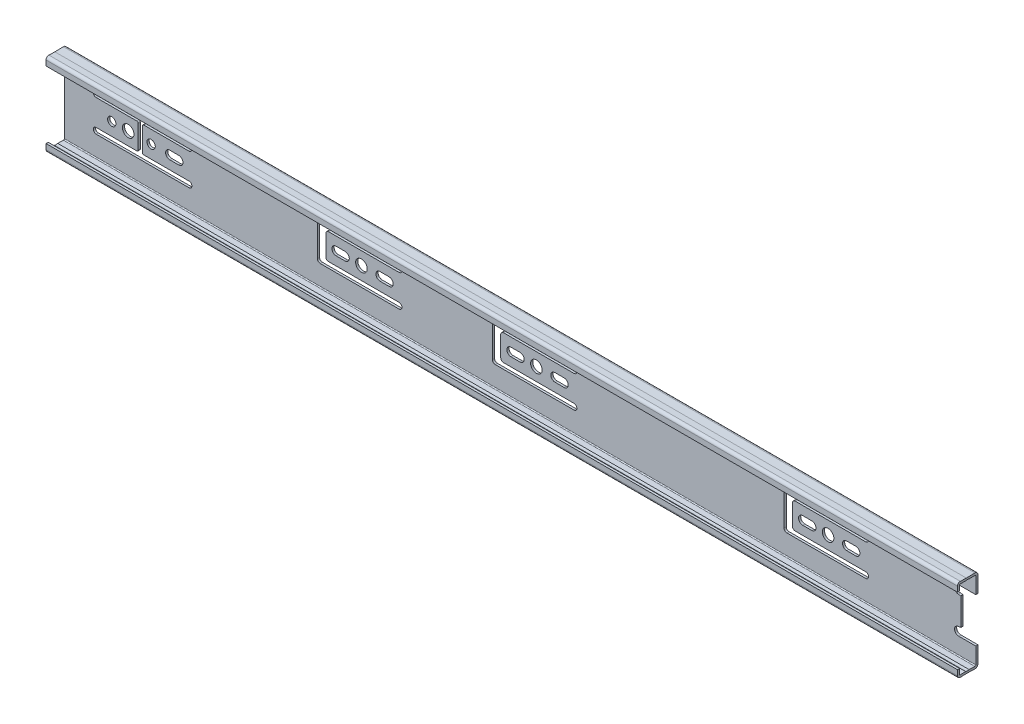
SolidWorks part; units mm, degrees
ref_plane "Front Plane" through (0, 0, 0) normal (0, 0, 1) x (1, 0, 0)
ref_plane "Top Plane" through (0, 0, 0) normal (0, 1, 0) x (1, 0, 0)
ref_plane "Right Plane" through (0, 0, 0) normal (1, 0, 0) x (0, 0, -1)
imported_body "Imported3"
sketch "Sketch1" plane through (240.6664, 0, 0) normal (1, 0, 0) x (0, 0, -1)
  line L0 (-4.445, 22.866) -> (5.6388, 22.866)
  line L1 (5.6388, 22.866) -> (5.6388, 12.2048)
  line L2 (5.6388, 12.2048) -> (4.445, 12.2048)
  line L3 (4.445, 12.2048) -> (4.445, 21.6406)
  line L4 (4.445, 21.6406) -> (0.7619, 21.5441)
  line L5 (-1.1312, 21.5182) -> (-4.445, 21.6367)
  line L6 (-4.445, 21.6367) -> (-4.445, 22.866)
  arc A0 (0.7619, 21.5441) -> (-1.1312, 21.5182) centre (-0.1524, 19.1744) ccw
  dimension "D1" = 2.54
  dimension "D2" = 3.3138
  dimension "D3" = 4.2926
  dimension "D4" = 5.2069
  dimension "D5" = 8.89
  dimension "D6" = 10.0838
  dimension "D7" = 0.0039
  dimension "D8" = 1.2294
  dimension "D9" = 1.2333
  dimension "D10" = 1.3259
  dimension "D13" = 10.6652
extrude "Boss-Extrude1" add sketch "Sketch1" along normal blind 9.3966
sketch "Sketch2" plane through (240.6664, 0, 0) normal (1, 0, 0) x (0, 0, -1)
  line L0 (-4.445, -21.6367) -> (-1.1312, -21.5182)
  line L1 (0.7619, -21.5441) -> (4.445, -21.6406)
  line L2 (4.445, -21.6406) -> (4.445, -12.2048)
  line L3 (4.445, -12.2048) -> (5.6388, -12.2048)
  line L4 (5.6388, -12.2048) -> (5.6388, -22.866)
  line L5 (5.6388, -22.866) -> (-4.445, -22.866)
  line L6 (-4.445, -22.866) -> (-4.445, -21.6367)
  line L7 (5.6388, -12.2048) -> (5.6388, -22.866) construction
  arc A0 (-1.1312, -21.5182) -> (0.7619, -21.5441) centre (-0.1524, -19.1744) ccw
  dimension "D1" = 2.54
  dimension "D2" = 1.1938
  dimension "D3" = 4.8769
  dimension "D4" = 5.7912
  dimension "D5" = 6.77
  dimension "D6" = 10.0838
  dimension "D7" = 6.9696
  dimension "D10" = 9.4319
  dimension "D11" = 9.4358
  dimension "D12" = 10.6613
extrude "Boss-Extrude2" add sketch "Sketch2" along normal blind 9.3966
sketch "Sketch3" plane through (0, 0, 4.445) normal (0, 0, 1) x (1, 0, 0)
  line L0 (250.063, 18.415) -> (-250.063, 18.415)
  line L1 (-250.063, 18.415) -> (-250.063, 22.8739)
  line L2 (250.063, 22.8739) -> (250.063, 18.415)
  line L3 (250.063, 22.866) -> (250.063, 21.6367) construction
  line L4 (250.063, 21.6367) -> (-250.063, 21.6367) construction
  spline S0 degree 3 poles (-250.063, 22.8739) (-83.3543, 22.8739) (83.3543, 22.8739) (250.063, 22.8739) knots 0 0 0 0 1 1 1 1
  dimension "D1" = 500.126
  dimension "D2" = 1.2372
  dimension "D3" = 3.2217
extrude "Boss-Extrude3" add sketch "Sketch3" along normal blind 0.9736
sketch "Sketch4" plane through (0, 0, 4.445) normal (0, 0, 1) x (1, 0, 0)
  line L0 (-250.063, -22.8739) -> (-250.063, -18.415)
  line L1 (-250.063, -18.415) -> (250.063, -18.415)
  line L2 (250.063, -18.415) -> (250.063, -22.8739)
  line L3 (250.063, -21.6367) -> (250.063, -22.866) construction
  spline S0 degree 3 poles (-250.063, -22.8739) (-83.3543, -22.8739) (83.3543, -22.8739) (250.063, -22.8739) knots 0 0 0 0 1 1 1 1
  dimension "D1" = 500.126
  dimension "D2" = 3.2217
  dimension "D3" = 1.2372
extrude "Boss-Extrude4" add sketch "Sketch4" along normal blind 0.9736
sketch "Sketch5" plane through (0, 0, 5.4186) normal (0, 0, 1) x (1, 0, 0)
  line L0 (-250.063, -22.8739) -> (-250.063, -18.415)
  line L1 (-250.063, -18.415) -> (250.063, -18.415)
  line L2 (250.063, -18.415) -> (250.063, -22.8739)
  line L3 (250.063, -22.8739) -> (-250.063, -22.8739)
  line L4 (250.063, -22.8739) -> (250.063, -18.415) construction
  dimension "D1" = 500.126
  dimension "D2" = 4.4589
extrude "Boss-Extrude5" add sketch "Sketch5" along normal blind 0.2202
sketch "Sketch6" plane through (0, 0, 5.4186) normal (0, 0, 1) x (1, 0, 0)
  line L0 (250.063, 18.415) -> (-250.063, 18.415)
  line L1 (-250.063, 18.415) -> (-250.063, 22.8739)
  line L2 (-250.063, 22.8739) -> (250.063, 22.8739)
  line L3 (250.063, 22.8739) -> (250.063, 18.415)
  line L4 (250.063, 18.415) -> (250.063, 22.8739) construction
  dimension "D1" = 500.126
  dimension "D2" = 4.4589
extrude "Boss-Extrude6" add sketch "Sketch6" along normal blind 0.2202
sketch "Sketch7" plane through (0, 0, -5.6388) normal (0, 0, -1) x (-1, 0, 0)
  line L0 (207.2652, -7.112) -> (181.6747, -7.112)
  line L1 (181.6747, -10.287) -> (232.6017, -10.287)
  line L2 (232.6017, -7.112) -> (209.5512, -7.112)
  line L3 (209.5512, -7.112) -> (209.5512, 7.112)
  line L4 (209.5512, 7.112) -> (232.6017, 7.112)
  line L5 (232.6017, 10.287) -> (181.6747, 10.287)
  line L6 (181.6747, 7.112) -> (207.2652, 7.112)
  line L7 (207.2652, 7.112) -> (207.2652, -7.112)
  line L8 (-250.063, 12.2048) -> (-250.063, 22.866) construction
  line L9 (250.063, 22.866) -> (-250.063, 22.866) construction
  arc A0 (181.6747, -7.112) -> (181.6747, -10.287) centre (181.6747, -8.6995) ccw
  arc A1 (232.6017, -10.287) -> (232.6017, -7.112) centre (232.6017, -8.6995) ccw
  arc A2 (232.6017, 7.112) -> (232.6017, 10.287) centre (232.6017, 8.6995) ccw
  arc A3 (181.6747, 10.287) -> (181.6747, 7.112) centre (181.6747, 8.6995) ccw
  dimension "D1" = 1.5875
  dimension "D2" = 1.5875
  dimension "D3" = 431.7377
  dimension "D4" = 457.3282
  dimension "D5" = 459.6142
  dimension "D6" = 482.6647
  dimension "D7" = 14.1665
  dimension "D8" = 31.5655
extrude "Cut-Extrude1" cut sketch "Sketch7" against normal through all
sketch "Sketch8" plane through (0, 0, -5.6388) normal (0, 0, -1) x (-1, 0, 0)
  line L0 (106.621, -7.112) -> (66.4255, -7.112)
  line L1 (66.4255, -10.287) -> (111.193, -10.287)
  line L2 (111.193, -10.287) -> (111.193, 10.287)
  line L3 (111.193, 10.287) -> (66.4255, 10.287)
  line L4 (66.4255, 7.112) -> (106.621, 7.112)
  line L5 (106.621, 7.112) -> (106.621, -7.112)
  line L6 (209.5512, -7.112) -> (209.5512, 7.112) construction
  line L7 (181.6747, -10.287) -> (232.6017, -10.287) construction
  arc A0 (66.4255, -7.112) -> (66.4255, -10.287) centre (66.4255, -8.6995) ccw
  arc A1 (66.4255, 10.287) -> (66.4255, 7.112) centre (66.4255, 8.6995) ccw
  dimension "D1" = 1.5875
  dimension "D2" = 1.5875
  dimension "D3" = 98.3582
  dimension "D4" = 102.9302
  dimension "D5" = 143.1257
  dimension "D6" = 1.5875
  dimension "D7" = 18.9865
extrude "Cut-Extrude2" cut sketch "Sketch8" against normal through all
sketch "Sketch9" plane through (0, 0, -5.6388) normal (0, 0, -1) x (-1, 0, 0)
  line L0 (187.2881, -2.286) -> (192.2411, -2.286)
  line L1 (192.2411, 2.286) -> (187.2881, 2.286)
  line L2 (209.5512, -7.112) -> (209.5512, 7.112) construction
  line L3 (66.4255, -10.287) -> (111.193, -10.287) construction
  arc A0 (192.2411, -2.286) -> (192.2411, 2.286) centre (192.2411, 0) ccw
  arc A1 (187.2881, 2.286) -> (187.2881, -2.286) centre (187.2881, 0) ccw
  dimension "D1" = 2.286
  dimension "D2" = 17.3101
  dimension "D3" = 22.2631
  dimension "D4" = 10.287
extrude "Cut-Extrude3" cut sketch "Sketch9" against normal through all
sketch "Sketch10" plane through (0, 0, -5.6388) normal (0, 0, -1) x (-1, 0, 0)
  line L0 (10.621, -7.112) -> (-29.5745, -7.112)
  line L1 (-29.5745, -10.287) -> (15.193, -10.287)
  line L2 (15.193, -10.287) -> (15.193, 10.287)
  line L3 (15.193, 10.287) -> (-29.5745, 10.287)
  line L4 (-29.5745, 7.112) -> (10.621, 7.112)
  line L5 (10.621, 7.112) -> (10.621, -7.112)
  line L6 (207.2652, 7.112) -> (207.2652, -7.112) construction
  line L7 (66.4255, -10.287) -> (111.193, -10.287) construction
  arc A0 (-29.5745, -7.112) -> (-29.5745, -10.287) centre (-29.5745, -8.6995) ccw
  arc A1 (-29.5745, 10.287) -> (-29.5745, 7.112) centre (-29.5745, 8.6995) ccw
  dimension "D1" = 1.5875
  dimension "D2" = 1.5875
  dimension "D3" = 192.0722
  dimension "D4" = 196.6442
  dimension "D5" = 236.8397
  dimension "D6" = 1.5875
  dimension "D7" = 18.9865
extrude "Cut-Extrude4" cut sketch "Sketch10" against normal through all
sketch "Sketch11" plane through (0, 0, -5.6388) normal (0, 0, -1) x (-1, 0, 0)
  line L0 (96.0165, -2.286) -> (100.9695, -2.286)
  line L1 (100.9695, 2.286) -> (96.0165, 2.286)
  line L2 (207.2652, 7.112) -> (207.2652, -7.112) construction
  line L3 (66.4255, -10.287) -> (111.193, -10.287) construction
  arc A0 (100.9695, -2.286) -> (100.9695, 2.286) centre (100.9695, 0) ccw
  arc A1 (96.0165, 2.286) -> (96.0165, -2.286) centre (96.0165, 0) ccw
  dimension "D1" = 2.286
  dimension "D2" = 106.2957
  dimension "D3" = 111.2487
  dimension "D4" = 10.287
extrude "Cut-Extrude5" cut sketch "Sketch11" against normal through all
sketch "Sketch12" plane through (0, 0, -5.6388) normal (0, 0, -1) x (-1, 0, 0)
  line L0 (71.8865, -2.286) -> (76.8395, -2.286)
  line L1 (76.8395, 2.286) -> (71.8865, 2.286)
  line L2 (10.621, 7.112) -> (10.621, -7.112) construction
  line L3 (-29.5745, -10.287) -> (15.193, -10.287) construction
  arc A0 (76.8395, -2.286) -> (76.8395, 2.286) centre (76.8395, 0) ccw
  arc A1 (71.8865, 2.286) -> (71.8865, -2.286) centre (71.8865, 0) ccw
  dimension "D1" = 2.286
  dimension "D2" = 61.2655
  dimension "D3" = 66.2185
  dimension "D4" = 10.287
extrude "Cut-Extrude6" cut sketch "Sketch12" against normal through all
sketch "Sketch13" plane through (0, 0, -5.6388) normal (0, 0, -1) x (-1, 0, 0)
  line L0 (-149.427, -7.112) -> (-189.6225, -7.112)
  line L1 (-189.6225, -10.287) -> (-144.855, -10.287)
  line L2 (-144.855, -10.287) -> (-144.855, 10.287)
  line L3 (-144.855, 10.287) -> (-189.6225, 10.287)
  line L4 (-189.6225, 7.112) -> (-149.427, 7.112)
  line L5 (-149.427, 7.112) -> (-149.427, -7.112)
  line L6 (10.621, 7.112) -> (10.621, -7.112) construction
  line L7 (-29.5745, -10.287) -> (15.193, -10.287) construction
  arc A0 (-189.6225, -7.112) -> (-189.6225, -10.287) centre (-189.6225, -8.6995) ccw
  arc A1 (-189.6225, 10.287) -> (-189.6225, 7.112) centre (-189.6225, 8.6995) ccw
  dimension "D1" = 1.5875
  dimension "D2" = 1.5875
  dimension "D3" = 155.476
  dimension "D4" = 160.048
  dimension "D5" = 200.2435
  dimension "D6" = 1.5875
  dimension "D7" = 18.9865
extrude "Cut-Extrude7" cut sketch "Sketch13" against normal through all
sketch "Sketch14" plane through (0, 0, -5.6388) normal (0, 0, -1) x (-1, 0, 0)
  line L0 (0.0165, -2.286) -> (4.9695, -2.286)
  line L1 (4.9695, 2.286) -> (0.0165, 2.286)
  line L2 (-149.427, 7.112) -> (-149.427, -7.112) construction
  line L3 (-29.5745, -10.287) -> (15.193, -10.287) construction
  arc A0 (4.9695, -2.286) -> (4.9695, 2.286) centre (4.9695, 0) ccw
  arc A1 (0.0165, 2.286) -> (0.0165, -2.286) centre (0.0165, 0) ccw
  dimension "D1" = 2.286
  dimension "D2" = 149.4435
  dimension "D3" = 154.3965
  dimension "D4" = 10.287
extrude "Cut-Extrude8" cut sketch "Sketch14" against normal through all
sketch "Sketch15" plane through (0, 0, -5.6388) normal (0, 0, -1) x (-1, 0, 0)
  line L0 (-24.1135, -2.286) -> (-19.1605, -2.286)
  line L1 (-19.1605, 2.286) -> (-24.1135, 2.286)
  line L2 (-149.427, 7.112) -> (-149.427, -7.112) construction
  line L3 (-29.5745, -10.287) -> (15.193, -10.287) construction
  arc A0 (-19.1605, -2.286) -> (-19.1605, 2.286) centre (-19.1605, 0) ccw
  arc A1 (-24.1135, 2.286) -> (-24.1135, -2.286) centre (-24.1135, 0) ccw
  dimension "D1" = 2.286
  dimension "D2" = 125.3135
  dimension "D3" = 130.2665
  dimension "D4" = 10.287
extrude "Cut-Extrude9" cut sketch "Sketch15" against normal through all
sketch "Sketch16" plane through (0, 0, -5.6388) normal (0, 0, -1) x (-1, 0, 0)
  line L0 (-184.1615, -2.286) -> (-179.2085, -2.286)
  line L1 (-179.2085, 2.286) -> (-184.1615, 2.286)
  line L2 (-149.427, 7.112) -> (-149.427, -7.112) construction
  line L3 (-29.5745, -10.287) -> (15.193, -10.287) construction
  arc A0 (-179.2085, -2.286) -> (-179.2085, 2.286) centre (-179.2085, 0) ccw
  arc A1 (-184.1615, 2.286) -> (-184.1615, -2.286) centre (-184.1615, 0) ccw
  dimension "D1" = 2.286
  dimension "D2" = 29.7815
  dimension "D3" = 34.7345
  dimension "D4" = 10.287
extrude "Cut-Extrude10" cut sketch "Sketch16" against normal through all
sketch "Sketch17" plane through (0, 0, -4.445) normal (0, 0, 1) x (1, 0, 0)
  line L0 (160.0315, 2.286) -> (155.0785, 2.286)
  line L1 (155.0785, -2.286) -> (160.0315, -2.286)
  line L2 (149.427, 7.112) -> (149.427, -7.112) construction
  line L3 (29.5745, -10.287) -> (-15.193, -10.287) construction
  arc A0 (160.0315, -2.286) -> (160.0315, 2.286) centre (160.0315, 0) ccw
  arc A1 (155.0785, 2.286) -> (155.0785, -2.286) centre (155.0785, 0) ccw
  dimension "D1" = 2.286
  dimension "D2" = 5.6515
  dimension "D3" = 10.6045
  dimension "D4" = 10.287
extrude "Cut-Extrude11" cut sketch "Sketch17" against normal through all
draft "Draft1" type of draft neutral plane draft angle 2.047 faces to draft 1 parameters "D1"=2.047
draft "Draft2" type of draft neutral plane draft angle 2.047 faces to draft 1 parameters "D1"=2.047
draft "Draft3" type of draft neutral plane draft angle 1.5 faces to draft 2 parameters "D1"=1.5
hole_wizard "M4 Clearance Hole1" positions "Sketch19" profile "Sketch18" hole size "M4" standard "ANSI Metric"
sketch "Sketch19" plane through (0, 0, -4.445) normal (0, 0, 1) x (1, 0, 0)
  point P0 (-224.0546, 0)
  point P1 (-202.4646, 0)
sketch "Sketch18" plane through (-224.0546, 0, -4.445) normal (1, 0, 0) x (0, -1, 0)
  line L0 (0, 0) -> (0, 1.1938)
  line L1 (0, 1.1938) -> (2.286, 1.1938)
  line L2 (2.286, 1.1938) -> (2.286, 0)
  line L5 (2.286, 0) -> (0, 0)
  line L11 (0, -6.35) -> (0, 107.95) construction
  dimension "Thru Hole Dia." = 4.572
  dimension "Thru Hole Depth" = 1.1938
hole_wizard "Hole1" positions "Sketch21" profile "Sketch20" legacy
sketch "Sketch21" plane through (0, 0, -4.445) normal (0, 0, 1) x (1, 0, 0)
  point P0 (168.985, 0)
  point P1 (8.937, 0)
  point P2 (-87.063, 0)
  point P3 (-215.063, 0)
sketch "Sketch20" plane through (168.985, 0, -4.445) normal (1, 0, 0) x (0, -1, 0)
  line L0 (0, 0) -> (0, 1.1938)
  line L1 (0, 1.1938) -> (3.175, 1.1938)
  line L2 (3.175, 1.1938) -> (3.175, 0)
  line L3 (3.175, 0) -> (0, 0)
  line L4 (0, 110) -> (0, -10) construction
  dimension "Diameter" = 6.35
  dimension "Depth" = 1.1938
fillet "Fillet1" radius 0.254 3 edges at (0, -21.6367, 4.445) (0, 21.6367, 4.445)
fillet "Fillet2" radius 0.508 2 edges at (0, -21.6406, -4.445) (0, 21.6406, -4.445)
fillet "Fillet3" radius 0.762 4 edges at (-207.2652, -7.112, -5.0419) (-209.5512, -7.112, -5.0419) (-207.2652, 7.112, -5.0419) (-209.5512, 7.112, -5.0419)
fillet "Fillet4" radius 1.524 14 edges at (0, -22.8739, 5.6388) (0, 22.8739, 5.6388) (-106.621, -7.112, -5.0419) (-106.621, 7.112, -5.0419) (-111.193, 10.287, -5.0419) (-111.193, -10.287, -5.0419) (-10.621, -7.112, -5.0419) (-10.621, 7.112, -5.0419) (-15.193, 10.287, -5.0419) (-15.193, -10.287, -5.0419) (149.427, -7.112, -5.0419) (149.427, 7.112, -5.0419) (144.855, 10.287, -5.0419) (144.855, -10.287, -5.0419)
fillet "Fillet5" radius 1.7018 2 edges at (0, -22.866, -5.6388) (0, 22.866, -5.6388)
